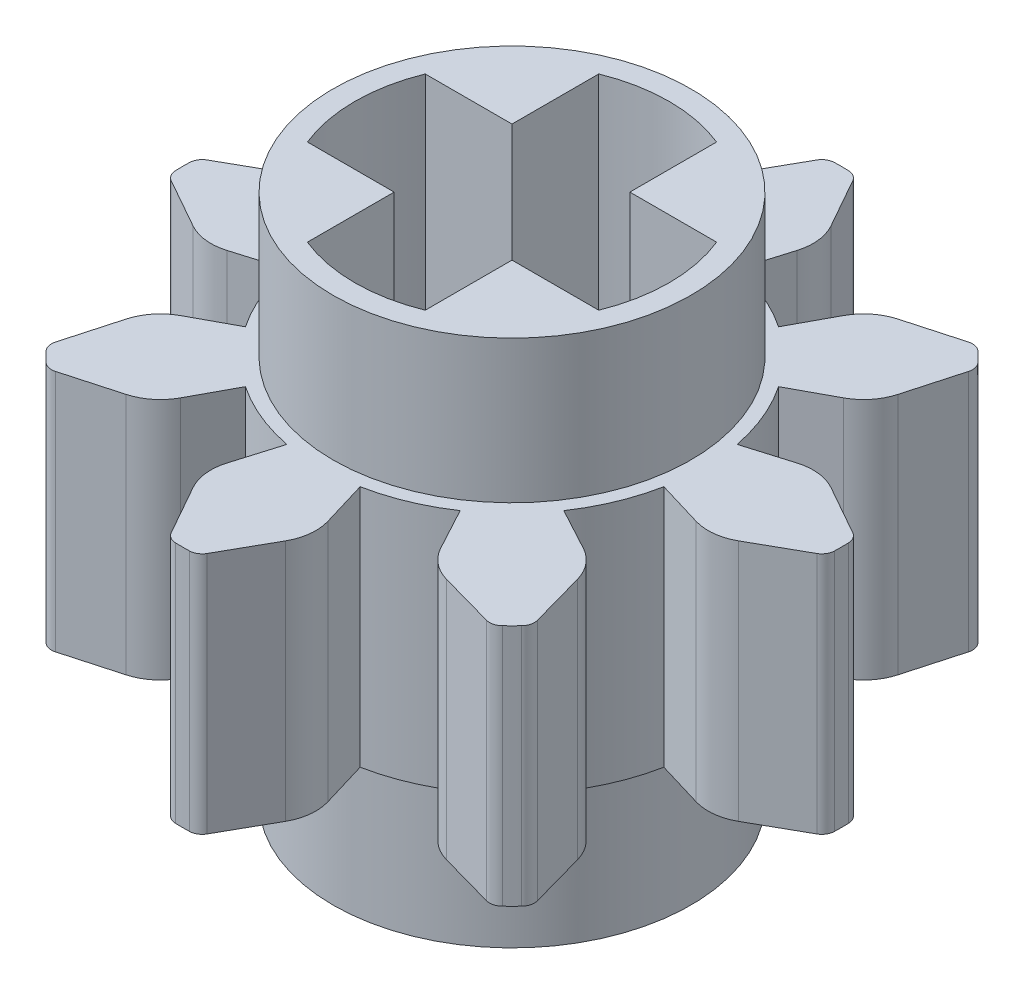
SolidWorks part; units mm, degrees
ref_plane "Front Plane" through (0, 0, 0) normal (0, 0, 1) x (1, 0, 0)
ref_plane "Top Plane" through (0, 0, 0) normal (0, 1, 0) x (1, 0, 0)
ref_plane "Right Plane" through (0, 0, 0) normal (1, 0, 0) x (0, 0, -1)
ref_plane "Plane1" through (0, 1.855, 0) normal (0, 1, 0) x (-1, 0, 0)
sketch "Sketch1" plane through (0, 1.855, 0) normal (0, 1, 0) x (-1, 0, 0)
  line L0 (5.0277, 0.2195) -> (3.8881, 0.862)
  line L1 (3.8881, 0.862) -> (2.8786, 0.5595)
  line L2 (2.4312, 1.6398) -> (3.3588, 2.1398)
  line L3 (3.3588, 2.1398) -> (3.7103, 3.3999)
  line L4 (3.3999, 3.7103) -> (2.1398, 3.3588)
  line L5 (2.1398, 3.3588) -> (1.6398, 2.4312)
  line L6 (0.5595, 2.8786) -> (0.862, 3.8881)
  line L7 (0.862, 3.8881) -> (0.2195, 5.0277)
  line L8 (-0.2195, 5.0277) -> (-0.862, 3.8881)
  line L9 (-0.862, 3.8881) -> (-0.5595, 2.8786)
  line L10 (-1.6398, 2.4312) -> (-2.1398, 3.3588)
  line L11 (-2.1398, 3.3588) -> (-3.3999, 3.7103)
  line L12 (-3.7103, 3.3999) -> (-3.3588, 2.1398)
  line L13 (-3.3588, 2.1398) -> (-2.4312, 1.6398)
  line L14 (-2.8786, 0.5595) -> (-3.8881, 0.862)
  line L15 (-3.8881, 0.862) -> (-5.0277, 0.2195)
  line L16 (-5.0277, -0.2195) -> (-3.8881, -0.862)
  line L17 (-3.8881, -0.862) -> (-2.8786, -0.5595)
  line L18 (-2.4312, -1.6398) -> (-3.3588, -2.1398)
  line L19 (-3.3588, -2.1398) -> (-3.7103, -3.3999)
  line L20 (-3.3999, -3.7103) -> (-2.1398, -3.3588)
  line L21 (-2.1398, -3.3588) -> (-1.6398, -2.4312)
  line L22 (-0.5595, -2.8786) -> (-0.862, -3.8881)
  line L23 (-0.862, -3.8881) -> (-0.2195, -5.0277)
  line L24 (0.2195, -5.0277) -> (0.862, -3.8881)
  line L25 (0.862, -3.8881) -> (0.5595, -2.8786)
  line L26 (1.6398, -2.4312) -> (2.1398, -3.3588)
  line L27 (2.1398, -3.3588) -> (3.3999, -3.7103)
  line L28 (3.7103, -3.3999) -> (3.3588, -2.1398)
  line L29 (3.3588, -2.1398) -> (2.4312, -1.6398)
  line L30 (2.8786, -0.5595) -> (3.8881, -0.862)
  line L31 (3.8881, -0.862) -> (5.0277, -0.2195)
  arc A0 (5.0277, -0.2195) -> (5.0277, 0.2195) centre (0, 0) ccw
  arc A1 (2.8786, 0.5595) -> (2.4312, 1.6398) centre (0, 0) ccw
  arc A2 (3.7103, 3.3999) -> (3.3999, 3.7103) centre (0, 0) ccw
  arc A3 (1.6398, 2.4312) -> (0.5595, 2.8786) centre (0, 0) ccw
  arc A4 (0.2195, 5.0277) -> (-0.2195, 5.0277) centre (0, 0) ccw
  arc A5 (-0.5595, 2.8786) -> (-1.6398, 2.4312) centre (0, 0) ccw
  arc A6 (-3.3999, 3.7103) -> (-3.7103, 3.3999) centre (0, 0) ccw
  arc A7 (-2.4312, 1.6398) -> (-2.8786, 0.5595) centre (0, 0) ccw
  arc A8 (-5.0277, 0.2195) -> (-5.0277, -0.2195) centre (0, 0) ccw
  arc A9 (-2.8786, -0.5595) -> (-2.4312, -1.6398) centre (0, 0) ccw
  arc A10 (-3.7103, -3.3999) -> (-3.3999, -3.7103) centre (0, 0) ccw
  arc A11 (-1.6398, -2.4312) -> (-0.5595, -2.8786) centre (0, 0) ccw
  arc A12 (-0.2195, -5.0277) -> (0.2195, -5.0277) centre (0, 0) ccw
  arc A13 (0.5595, -2.8786) -> (1.6398, -2.4312) centre (0, 0) ccw
  arc A14 (3.3999, -3.7103) -> (3.7103, -3.3999) centre (0, 0) ccw
  arc A15 (2.4312, -1.6398) -> (2.8786, -0.5595) centre (0, 0) ccw
extrude "Boss-Extrude1" add sketch "Sketch1" against normal blind 3.71
sketch "Sketch2" plane through (0, 1.855, 0) normal (0, 1, 0) x (-1, 0, 0)
  circle A0 centre (0, 0) radius 2.7325
extrude "Boss-Extrude2" add sketch "Sketch2" along normal blind 2.1775
sketch "Sketch3" plane through (0, -1.855, 0) normal (0, -1, 0) x (1, 0, 0)
  circle A0 centre (0, 0) radius 2.7325
extrude "Boss-Extrude3" add sketch "Sketch3" along normal blind 2.1775
ref_plane "Plane2" through (0, -3.9, 0) normal (0, -1, 0) x (1, 0, 0)
ref_plane "Plane3" through (0, 3.9, 0) normal (0, 1, 0) x (-1, 0, 0)
fillet "Fillet5" radius 0.2 1 edges at (-3.7103, 0, -3.3999)
fillet "Fillet6" radius 0.2 1 edges at (5.0277, 0, -0.2195)
fillet "Fillet7" radius 0.2 1 edges at (-0.2195, 0, -5.0277)
fillet "Fillet8" radius 0.2 1 edges at (0.2195, 0, 5.0277)
fillet "Fillet9" radius 0.2 1 edges at (-5.0277, 0, -0.2195)
fillet "Fillet10" radius 0.2 1 edges at (3.7103, 0, 3.3999)
fillet "Fillet11" radius 0.2 1 edges at (0.2195, 0, -5.0277)
fillet "Fillet12" radius 0.2 1 edges at (-3.7103, 0, 3.3999)
fillet "Fillet13" radius 0.2 1 edges at (3.3999, 0, 3.7103)
fillet "Fillet14" radius 0.2 1 edges at (-0.2195, 0, 5.0277)
fillet "Fillet15" radius 0.2 1 edges at (3.3999, 0, -3.7103)
fillet "Fillet16" radius 0.2 1 edges at (3.7103, 0, -3.3999)
fillet "Fillet17" radius 0.2 1 edges at (-3.3999, 0, 3.7103)
fillet "Fillet19" radius 0.2 1 edges at (5.0277, 0, 0.2195)
fillet "Fillet22" radius 0.2 1 edges at (-3.3999, 0, -3.7103)
fillet "Fillet23" radius 0.2 1 edges at (-5.0277, 0, 0.2195)
fillet "Fillet25" radius 0.75 1 edges at (-2.1398, 0, 3.3588)
fillet "Fillet26" radius 0.75 1 edges at (0.862, 0, -3.8881)
fillet "Fillet27" radius 0.75 1 edges at (2.1398, 0, 3.3588)
fillet "Fillet28" radius 0.75 1 edges at (-3.8881, 0, -0.862)
fillet "Fillet29" radius 0.75 1 edges at (2.1398, 0, -3.3588)
fillet "Fillet30" radius 0.75 1 edges at (-3.3588, 0, -2.1398)
fillet "Fillet31" radius 0.75 1 edges at (3.3588, 0, 2.1398)
fillet "Fillet32" radius 0.75 1 edges at (-0.862, 0, 3.8881)
fillet "Fillet33" radius 0.75 1 edges at (3.3588, 0, -2.1398)
fillet "Fillet34" radius 0.75 1 edges at (0.862, 0, 3.8881)
fillet "Fillet35" radius 0.75 1 edges at (3.8881, 0, 0.862)
fillet "Fillet36" radius 0.75 1 edges at (-3.3588, 0, 2.1398)
fillet "Fillet37" radius 0.75 1 edges at (3.8881, 0, -0.862)
fillet "Fillet38" radius 0.75 1 edges at (-0.862, 0, -3.8881)
fillet "Fillet39" radius 0.75 1 edges at (-2.1398, 0, -3.3588)
fillet "Fillet40" radius 0.75 1 edges at (-3.8881, 0, 0.862)
sketch "Sketch4" plane through (0, -4.0325, 0) normal (0, -1, 0) x (1, 0, 0)
  line L0 (-3.0626, 0) -> (3.4887, 0) construction
  line L1 (0, 3.4154) -> (0, -4.1478) construction
  line L2 (-2.2249, 0.9) -> (-0.9, 0.9)
  line L3 (-2.2249, -0.9) -> (-0.9, -0.9)
  line L4 (-0.9, 2.2249) -> (-0.9, 0.9)
  line L5 (0.9, 2.2249) -> (0.9, 0.9)
  line L6 (0.9, 0.9) -> (2.2249, 0.9)
  line L7 (-0.9, -0.9) -> (-0.9, -2.2249)
  line L8 (0.9, -0.9) -> (2.2249, -0.9)
  line L9 (0.9, -0.9) -> (0.9, -2.2249)
  arc A0 (-2.2249, 0.9) -> (-2.2249, -0.9) centre (0, 0) ccw
  arc A4 (0.9, 2.2249) -> (-0.9, 2.2249) centre (0, 0) ccw
  arc A5 (2.2249, -0.9) -> (2.2249, 0.9) centre (0, 0) ccw
  arc A6 (-0.9, -2.2249) -> (0.9, -2.2249) centre (0, 0) ccw
  dimension "D1" = 4.8
  dimension "D2" = 1.8
  dimension "D3" = 1.8
  dimension "D4" = 0.9
  dimension "D5" = 0.9
extrude "Cut-Extrude1" cut sketch "Sketch4" against normal through all
